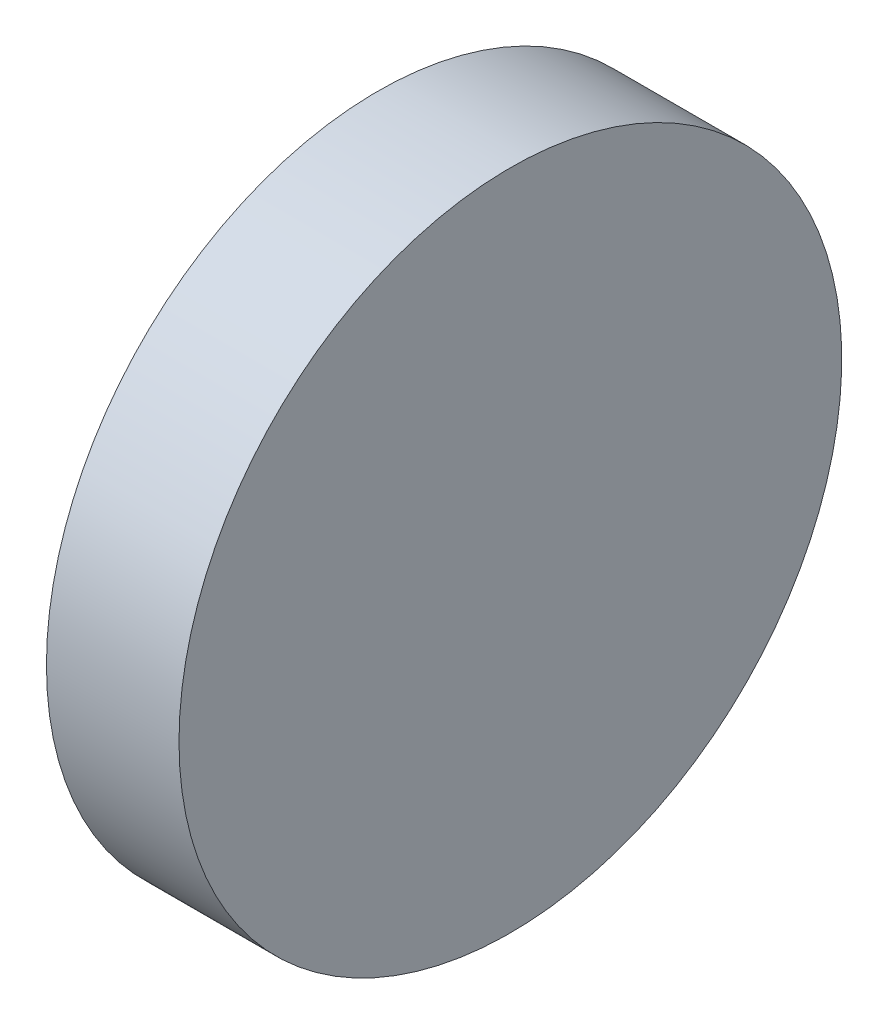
SolidWorks part; units mm, degrees
ref_plane "Front Plane" through (0, 0, 0) normal (0, 0, 1) x (1, 0, 0)
ref_plane "Top Plane" through (0, 0, 0) normal (0, 1, 0) x (1, 0, 0)
ref_plane "Right Plane" through (0, 0, 0) normal (1, 0, 0) x (0, 0, -1)
sketch "Sketch1" plane through (0, 0, 0) normal (0, 1, 0) x (1, 0, 0)
  line L0 (0, 0) -> (0, 31.75)
  line L1 (0, 31.75) -> (12.7, 31.75)
  line L2 (12.7, 31.75) -> (12.7, 0)
  line L3 (12.7, 0) -> (0, 0)
  line L4 (0, 0) -> (48.8345, 0) construction
  dimension "D1" = 31.75
revolve "Revolve1" add sketch "Sketch1" angle 360 about L4
